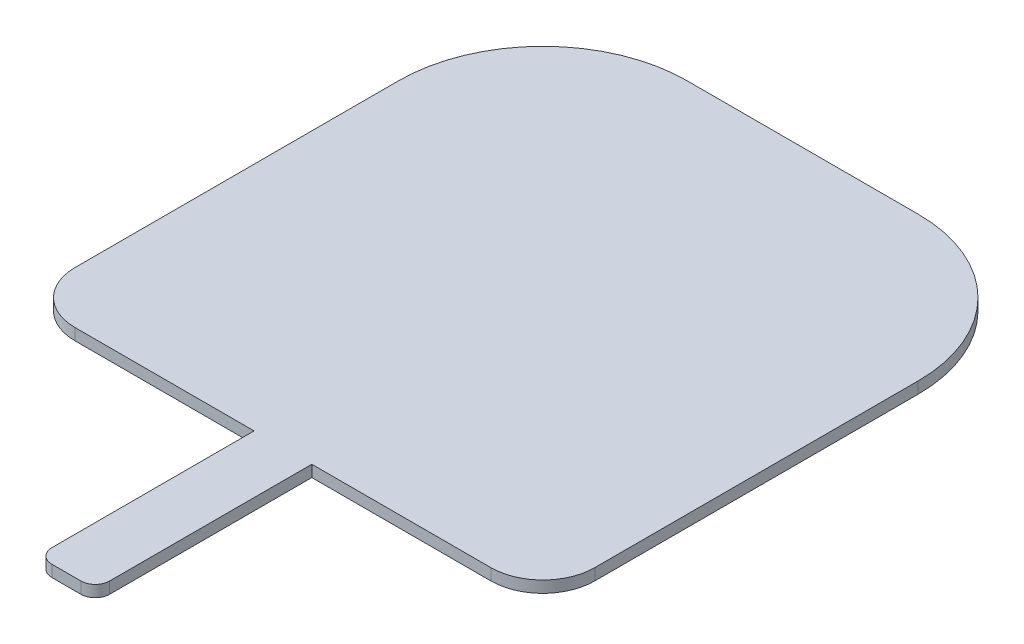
SolidWorks part; units mm, degrees
ref_plane "Front Plane" through (0, 0, 0) normal (0, 0, 1) x (1, 0, 0)
ref_plane "Top Plane" through (0, 0, 0) normal (0, 1, 0) x (1, 0, 0)
ref_plane "Right Plane" through (0, 0, 0) normal (1, 0, 0) x (0, 0, -1)
sketch "Sketch1" plane through (0, 0, 0) normal (0, 1, 0) x (1, 0, 0)
  line L1 (-180, -180) -> (180, -180)
  line L2 (-180, -180) -> (-180, 180)
  line L3 (-180, 180) -> (180, 180)
  line L4 (180, -180) -> (180, 180)
  line L5 (-180, -180) -> (180, 180) construction
  line L6 (-180, 180) -> (180, -180) construction
  point P0 (0, 0)
  dimension "D1" = 360
  dimension "D2" = 360
extrude "Boss-Extrude1" add sketch "Sketch1" along normal blind 8
fillet "Fillet1" radius 100 2 edges at (180, 4, -180) (-180, 4, -180)
sketch "Sketch2" plane through (0, 0, 0) normal (0, 1, 0) x (1, 0, 0)
  line L0 (-180, -180) -> (180, -180) construction
  line L1 (-20, -180) -> (20, -180)
  line L2 (-20, -180) -> (-20, -330)
  line L3 (-20, -330) -> (20, -330)
  line L4 (20, -180) -> (20, -330)
  dimension "D1" = 40
  dimension "D2" = 150
  dimension "D3" = 160
extrude "Boss-Extrude2" add sketch "Sketch2" along normal blind 8
fillet "Fillet2" radius 36 2 edges at (180, 4, 180) (-180, 4, 180)
fillet "Fillet3" radius 10 2 edges at (20, 4, 330) (-20, 4, 330)
